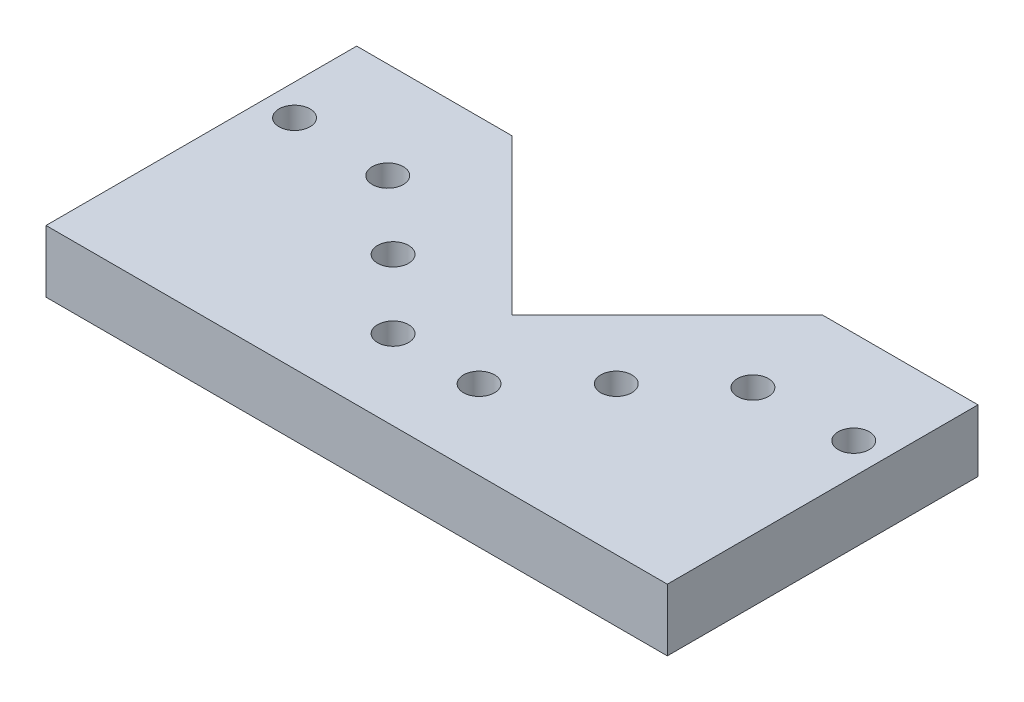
SolidWorks part; units mm, degrees
ref_plane "Front Plane" through (0, 0, 0) normal (0, 0, 1) x (1, 0, 0)
ref_plane "Top Plane" through (0, 0, 0) normal (0, 1, 0) x (1, 0, 0)
ref_plane "Right Plane" through (0, 0, 0) normal (1, 0, 0) x (0, 0, -1)
sketch "Sketch1" plane through (0, 0, 0) normal (0, 1, 0) x (1, 0, 0)
  line L0 (-75, 50) -> (-50, 25)
  line L1 (0, 0) -> (-100, 0)
  line L2 (0, 0) -> (0, 50)
  line L3 (0, 50) -> (-25, 50)
  line L4 (-100, 0) -> (-100, 50)
  line L5 (-50, 25) -> (-25, 50)
  line L6 (-50, 0) -> (-50, 25) construction
  line L7 (-75, 50) -> (-100, 50)
  dimension "D1" = 100
  dimension "D2" = 50
  dimension "D3" = 25
extrude "Extrude1" add sketch "Sketch1" along normal blind 10
sketch "Sketch2" plane through (0, 10, 0) normal (0, 1, 0) x (-1, 0, 0)
  line L0 (100, -50) -> (100, 0) construction
  line L8 (0, -40) -> (20.8579, -40)
  line L9 (20.8579, -40) -> (50, -10.8579)
  line L10 (50, -10.8579) -> (79.1421, -40)
  line L11 (79.1421, -40) -> (100, -40)
  line L12 (0, -40) -> (20.8579, -40) construction
  line L13 (20.8579, -40) -> (50, -10.8579) construction
  line L14 (50, -10.8579) -> (79.1421, -40) construction
  line L15 (79.1421, -40) -> (95, -40) construction
  spline S0 degree 3 poles (0, -40) (5.2145, -40) (10.4289, -40) (15.6434, -40) (17.251, -40) (20.4661, -40) (24.7332, -36.1247) (27.0067, -33.8512) (28.1434, -32.7145) (33.0004, -27.8574) (37.8574, -23.0004) (42.7145, -18.1434) (43.8593, -16.9986) (46.1489, -14.709) (53.8511, -14.709) (56.1407, -16.9986) (57.2855, -18.1434) (63.6366, -24.4945) (69.9877, -30.8456) (76.3388, -37.1967) (76.9144, -37.7722) (78.0654, -38.9233) (80.6648, -40) (82.2927, -40) (83.1066, -40) (87.0711, -40) (91.0355, -40) (95, -40) knots 0 0 0 0 0.140358 0.140358 0.140358 0.183629 0.226901 0.270172 0.270172 0.270172 0.455062 0.455062 0.455062 0.498641 0.542219 0.585798 0.585798 0.585798 0.827562 0.827562 0.827562 0.849471 0.87138 0.893288 0.893288 0.893288 1 1 1 1
  dimension "D2" = 5
  dimension "D1" = 10
sketch "Sketch3" plane through (0, 10, 0) normal (0, 1, 0) x (-1, 0, 0)
  line L0 (0, 0) -> (0, -50) construction
  line L1 (0, -40) -> (20.8579, -40) construction
  circle A0 centre (5, -35) radius 2.5
  dimension "D3" = 5
  dimension "D1" = 5
  dimension "D2" = 5
extrude "Cut-Extrude1" cut sketch "Sketch3" against normal through all
pattern_curve "CrvPattern1" of "Cut-Extrude1" parameters "D1"=8, "D3"=50, "D2"=1, "D4"=50
